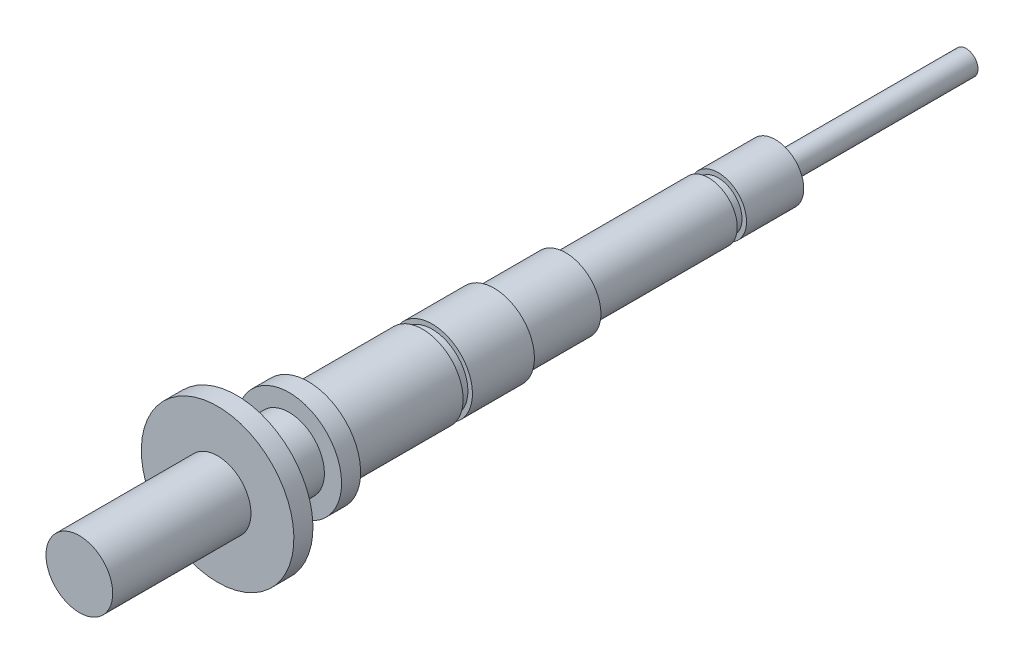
SolidWorks part; units mm, degrees
ref_plane "Front Plane" through (0, 0, 0) normal (0, 0, 1) x (1, 0, 0)
ref_plane "Top Plane" through (0, 0, 0) normal (0, 1, 0) x (1, 0, 0)
ref_plane "Right Plane" through (0, 0, 0) normal (1, 0, 0) x (0, 0, -1)
sketch "Sketch1" plane through (0, 0, 0) normal (1, 0, 0) x (0, 0, -1)
  line L0 (-126.3943, 0) -> (126.3943, 0) construction
  line L1 (-50, 19.3253) -> (-50, -19.3253) construction
  line L2 (50, 19.03) -> (50, -19.03) construction
  line L3 (-93, 0) -> (-93, 7)
  line L4 (-93, 7) -> (-64, 7)
  line L5 (-64, 7) -> (-64, 16)
  line L6 (-64, 16) -> (-60, 16)
  line L7 (-60, 16) -> (-60, 7.4)
  line L8 (-60, 7.4) -> (-49, 7.4)
  line L9 (-49, 7.4) -> (-49, 11)
  line L10 (-49, 11) -> (-45, 11)
  line L11 (-45, 11) -> (-45, 8.5)
  line L12 (-45, 8.5) -> (-21, 8.5)
  line L13 (-21, 8.5) -> (-21, 8.45)
  line L15 (-6, 8.45) -> (-6, 7.4)
  line L17 (-6, 7.4) -> (9, 7.4)
  line L18 (9, 7.4) -> (9, 6)
  line L21 (53, 5.95) -> (53, 2.5)
  line L22 (53, 2.5) -> (93, 2.5)
  line L23 (93, 2.5) -> (93, 0)
  line L24 (-93, 0) -> (93, 0)
  line L25 (-21, 8.45) -> (-21, 7.5)
  line L26 (-21, 7.5) -> (-19, 7.5)
  line L27 (-19, 7.5) -> (-19, 8.45)
  line L28 (-19, 8.45) -> (-6, 8.45)
  line L29 (9, 6) -> (39, 6)
  line L30 (39, 6) -> (39, 5)
  line L31 (39, 5) -> (41, 5)
  line L32 (41, 5) -> (41, 5.95)
  line L33 (41, 5.95) -> (53, 5.95)
  point P4 (0, 0)
  point P7 (-50, 0)
  point P10 (50, 0)
  point P36 (0, 0)
  dimension "D1" = 50
  dimension "D2" = 50
  dimension "D3" = 7
  dimension "D4" = 29
  dimension "D5" = 16
  dimension "D6" = 4
  dimension "D7" = 7.4
  dimension "D8" = 10
  dimension "D9" = 1
  dimension "D10" = 11
  dimension "D11" = 4
  dimension "D12" = 8.5
  dimension "D13" = 24
  dimension "D14" = 8.45
  dimension "D15" = 15
  dimension "D16" = 2
  dimension "D17" = 41
  dimension "D18" = 6
  dimension "D19" = 7.5
  dimension "D20" = 30
  dimension "D21" = 7.4
  dimension "D22" = 3
  dimension "D23" = 5
  dimension "D24" = 40
  dimension "D25" = 5.95
  dimension "D26" = 2
  dimension "D27" = 5
revolve "Revolve2" add sketch "Sketch1" angle 360 about L0
